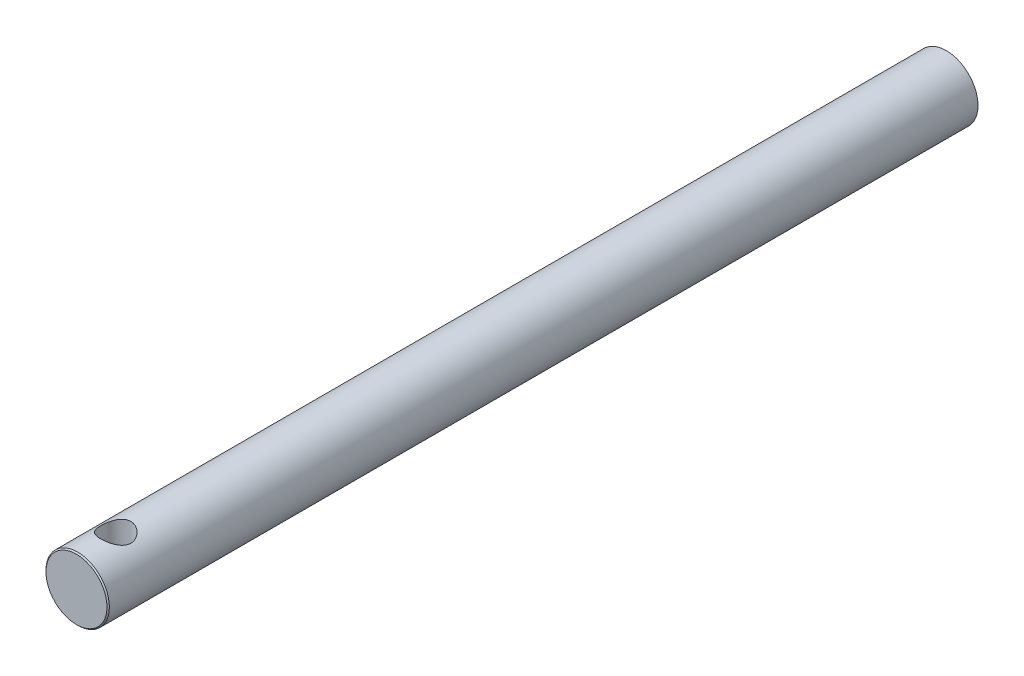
SolidWorks part; units mm, degrees
ref_plane "Plan de face" through (0, 0, 0) normal (0, 0, 1) x (1, 0, 0)
ref_plane "Plan de dessus" through (0, 0, 0) normal (0, 1, 0) x (1, 0, 0)
ref_plane "Plan de droite" through (0, 0, 0) normal (1, 0, 0) x (0, 0, -1)
sketch "Esquisse1" plane through (0, 0, 0) normal (0, 0, 1) x (1, 0, 0)
  circle A0 centre (0, 0) radius 5.25
extrude "Extrusion1" add sketch "Esquisse1" along normal blind 144
chamfer "Chanfrein1" distance 0.2 angle 45 1 edges at (5.25, 0, 144)
sketch "Esquisse2" plane through (0, 0, 0) normal (0, 1, 0) x (1, 0, 0)
  line L0 (0, -145.7368) -> (0, -134.5911) construction
  line L1 (-6.3991, -137.5) -> (7.5364, -137.5) construction
  circle A0 centre (0, -137.5) radius 2.5
extrude "Enlèv. mat.-Extru.1" cut sketch "Esquisse2" against normal through all and the other way through all
